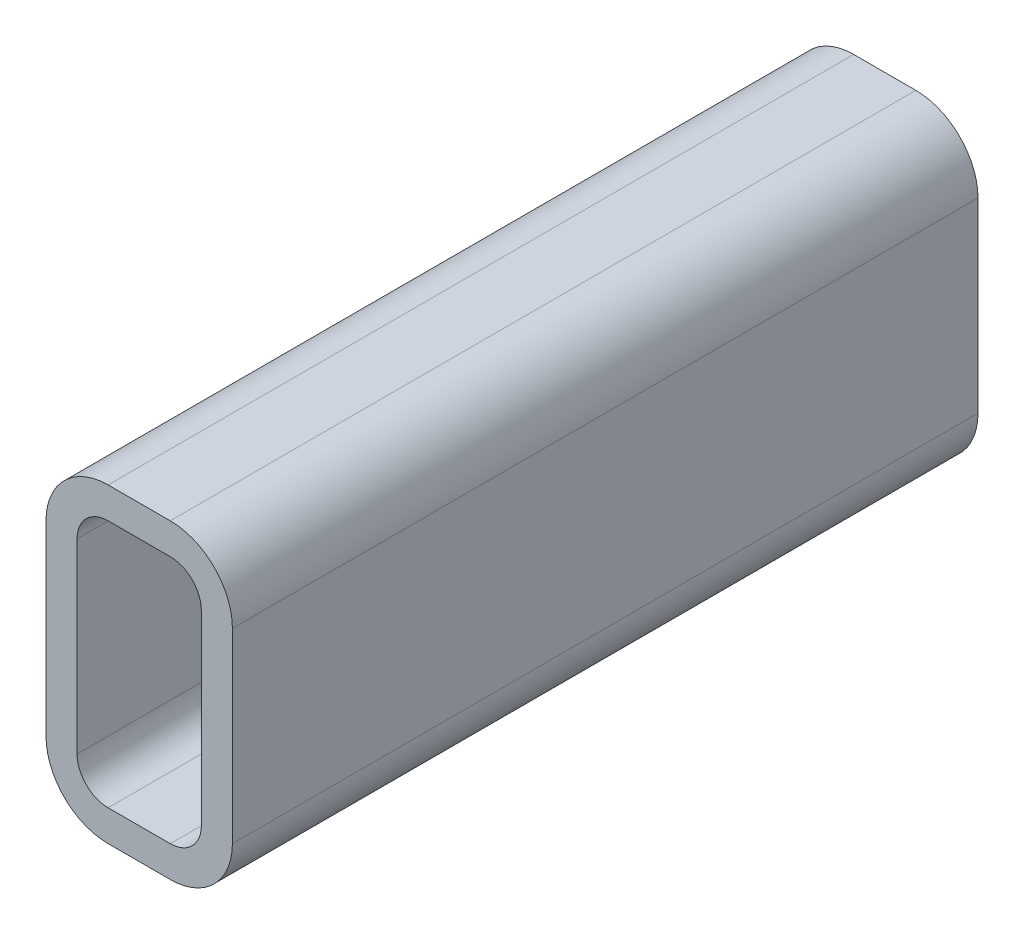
SolidWorks part; units mm, degrees
ref_plane "Front Plane" through (0, 0, 0) normal (0, 0, 1) x (1, 0, 0)
ref_plane "Top Plane" through (0, 0, 0) normal (0, 1, 0) x (1, 0, 0)
ref_plane "Right Plane" through (0, 0, 0) normal (1, 0, 0) x (0, 0, -1)
sketch "Sketch1" plane through (0, 0, 0) normal (0, 0, 1) x (1, 0, 0)
sketch_block_instance "HSS5x3x0.500-1"
sketch_block "HSS5x3x0.500"
extrude "Boss-Extrude1" add sketch "Sketch1" along normal blind 304.8
